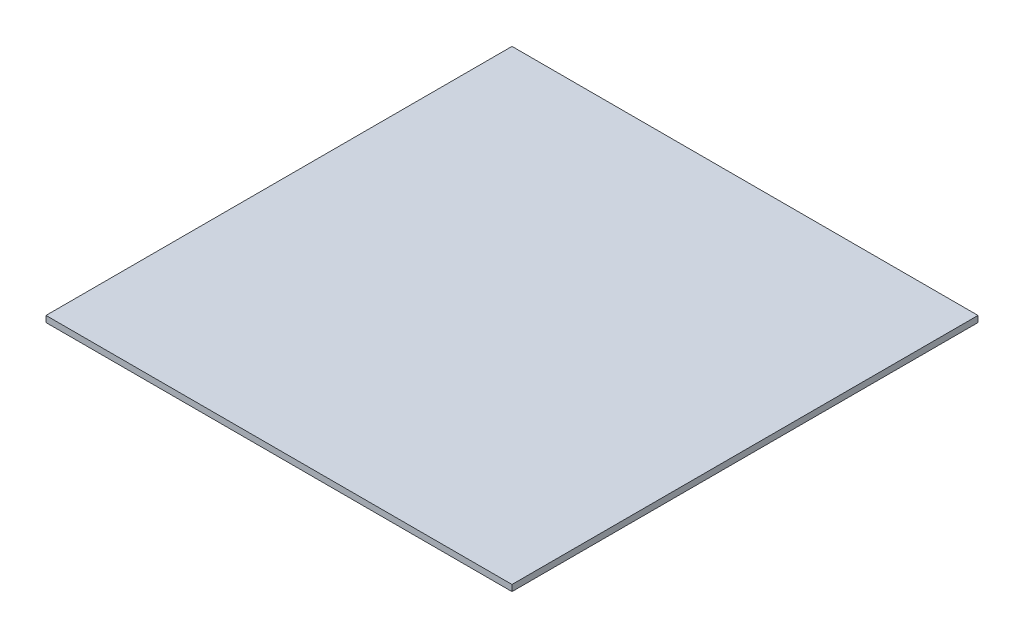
SolidWorks part; units mm, degrees
ref_plane "Front Plane" through (0, 0, 0) normal (0, 0, 1) x (1, 0, 0)
ref_plane "Top Plane" through (0, 0, 0) normal (0, 1, 0) x (1, 0, 0)
ref_plane "Right Plane" through (0, 0, 0) normal (1, 0, 0) x (0, 0, -1)
sketch "Sketch1" plane through (0, 0, 0) normal (0, 1, 0) x (1, 0, 0)
  line L1 (-75, 75) -> (75, 75)
  line L2 (-75, 75) -> (-75, -75)
  line L3 (-75, -75) -> (75, -75)
  line L4 (75, 75) -> (75, -75)
  line L5 (-75, 75) -> (75, -75) construction
  line L6 (-75, -75) -> (75, 75) construction
  point P0 (0, 0)
  dimension "D1" = 150
extrude "Boss-Extrude1" add sketch "Sketch1" along normal blind 2
equation "\"anch\"= 2"
equation "\"alt\"= 100"
equation "\"pilanch\"= 100"
equation "\"pilalt\"= 250"
equation "\"bodyHeigh\"= 60"
equation "\"D1@Boss-Extrude1\"=\"anch\""
